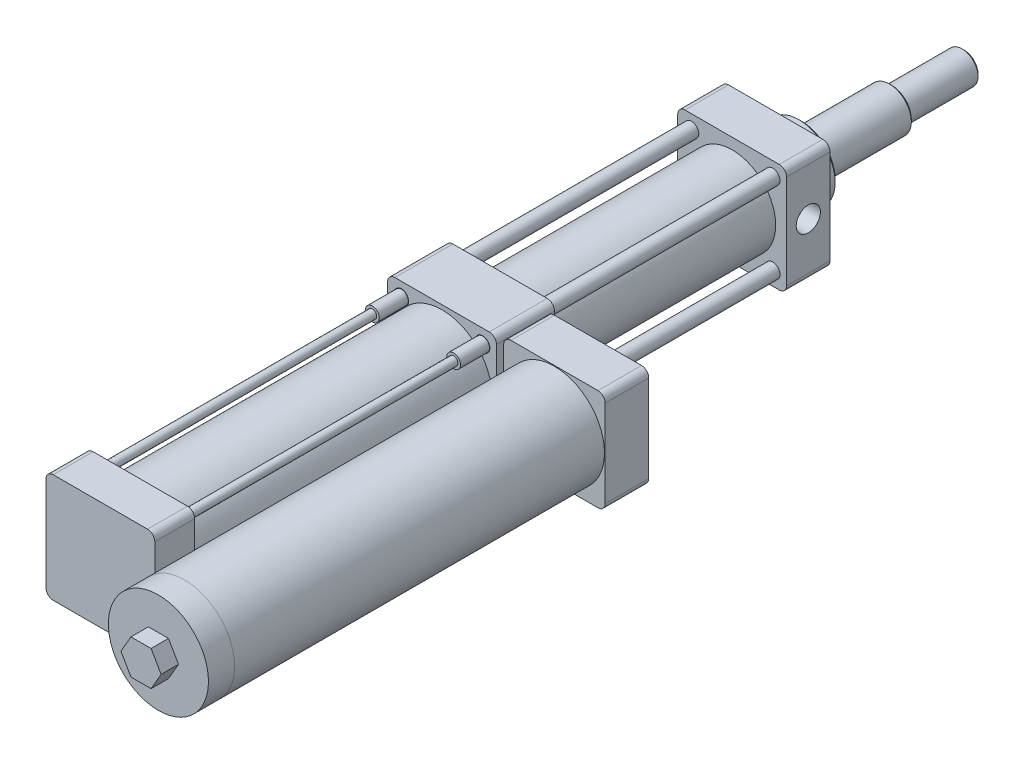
SolidWorks part; units mm, degrees
ref_plane "前视基准面" through (0, 0, 0) normal (0, 0, 1) x (1, 0, 0)
ref_plane "上视基准面" through (0, 0, 0) normal (0, 1, 0) x (1, 0, 0)
ref_plane "右视基准面" through (0, 0, 0) normal (1, 0, 0) x (0, 0, -1)
sketch "草图1" plane through (0, 0, 0) normal (0, 0, 1) x (1, 0, 0)
  line L0 (0, 0) -> (28, 0) construction
  line L1 (32.5, 37.5) -> (-32.5, 37.5)
  line L2 (37.5, 32.5) -> (37.5, -32.5)
  line L3 (32.5, -37.5) -> (-32.5, -37.5)
  line L4 (-37.5, 32.5) -> (-37.5, -32.5)
  line L5 (37.5, 37.5) -> (-37.5, -37.5) construction
  line L6 (37.5, -37.5) -> (-37.5, 37.5) construction
  line L7 (28, 0) -> (28, -28) construction
  arc A0 (-37.5, -32.5) -> (-32.5, -37.5) centre (-32.5, -32.5) ccw
  arc A1 (37.5, -32.5) -> (32.5, -37.5) centre (32.5, -32.5) cw
  arc A2 (32.5, 37.5) -> (37.5, 32.5) centre (32.5, 32.5) cw
  arc A3 (-37.5, 32.5) -> (-32.5, 37.5) centre (-32.5, 32.5) cw
  circle A4 centre (28, -28) radius 5
  circle A5 centre (-28, -28) radius 5
  circle A6 centre (-28, 28) radius 5
  circle A7 centre (28, 28) radius 5
  point P0 (0, 0)
  point P31 (0, 0)
  dimension "D3" = 5
  dimension "D4" = 4
  dimension "D1" = 75
  dimension "D2" = 75
extrude "凸台-拉伸1" add sketch "草图1" along normal blind 30
sketch "草图2" plane through (0, 0, 0) normal (0, 0, -1) x (-1, 0, 0)
  circle A0 centre (0, 0) radius 25
extrude "凸台-拉伸2" add sketch "草图2" along normal blind 18
sketch "草图3" plane through (0, 0, -18) normal (0, 0, -1) x (-1, 0, 0)
  circle A0 centre (0, 0) radius 15
extrude "凸台-拉伸3" add sketch "草图3" along normal blind 62
sketch "草图4" plane through (0, 0, -80) normal (0, 0, -1) x (-1, 0, 0)
  circle A0 centre (0, 0) radius 11
extrude "凸台-拉伸4" add sketch "草图4" along normal blind 50
chamfer "倒角1" distance 2 angle 45 1 edges at (-25, 0, -18)
chamfer "倒角2" distance 1.5 angle 45 2 edges at (-11, 0, -130) (-15, 0, -80)
sketch "草图5" plane through (0, 0, 30) normal (0, 0, 1) x (1, 0, 0)
  circle A0 centre (0, 0) radius 30
extrude "凸台-拉伸5" add sketch "草图5" along normal blind 160
sketch "草图6" plane through (0, 0, 190) normal (0, 0, 1) x (1, 0, 0)
  line L4 (-32.5, -37.5) -> (32.5, -37.5)
  line L5 (37.5, -32.5) -> (37.5, 32.5)
  line L6 (32.5, 37.5) -> (-32.5, 37.5)
  line L7 (-37.5, 32.5) -> (-37.5, -32.5)
  line L8 (-32.5, -37.5) -> (32.5, -37.5)
  line L9 (37.5, -32.5) -> (37.5, 32.5)
  line L10 (32.5, 37.5) -> (-32.5, 37.5)
  line L11 (-37.5, 32.5) -> (-37.5, -32.5)
  circle A0 centre (-28, -28) radius 5 construction
  circle A1 centre (-28, 28) radius 5 construction
  circle A2 centre (28, -28) radius 5 construction
  circle A3 centre (28, 28) radius 5 construction
  arc A4 (-37.5, -32.5) -> (-32.5, -37.5) centre (-32.5, -32.5) ccw
  arc A5 (32.5, -37.5) -> (37.5, -32.5) centre (32.5, -32.5) ccw
  arc A6 (37.5, 32.5) -> (32.5, 37.5) centre (32.5, 32.5) ccw
  arc A7 (-32.5, 37.5) -> (-37.5, 32.5) centre (-32.5, 32.5) ccw
  arc A8 (-37.5, -32.5) -> (-32.5, -37.5) centre (-32.5, -32.5) ccw
  arc A9 (32.5, -37.5) -> (37.5, -32.5) centre (32.5, -32.5) ccw
  arc A10 (37.5, 32.5) -> (32.5, 37.5) centre (32.5, 32.5) ccw
  arc A11 (-32.5, 37.5) -> (-37.5, 32.5) centre (-32.5, 32.5) ccw
  circle A12 centre (-28, -28) radius 5
  circle A13 centre (-28, 28) radius 5
  circle A14 centre (28, -28) radius 5
  circle A15 centre (28, 28) radius 5
  dimension "D1" = 0
extrude "凸台-拉伸6" add sketch "草图6" along normal blind 40
sketch "草图7" plane through (0, 0, 230) normal (0, 0, 1) x (1, 0, 0)
  circle A0 centre (0, 0) radius 34.5
extrude "凸台-拉伸7" add sketch "草图7" along normal blind 208
sketch "草图8" plane through (0, 0, 230) normal (0, 0, 1) x (1, 0, 0)
  circle A0 centre (28, 28) radius 4.75
  circle A1 centre (28, -28) radius 4.75
  circle A2 centre (-28, 28) radius 4.75
  circle A3 centre (-28, -28) radius 4.75
extrude "凸台-拉伸8" add sketch "草图8" along normal blind 20 separate body
sketch "草图9" plane through (0, 0, 438) normal (0, 0, 1) x (1, 0, 0)
  line L4 (-32.5, -37.5) -> (32.5, -37.5)
  line L5 (37.5, -32.5) -> (37.5, 32.5)
  line L6 (32.5, 37.5) -> (-32.5, 37.5)
  line L7 (-37.5, 32.5) -> (-37.5, -32.5)
  line L8 (-32.5, -37.5) -> (32.5, -37.5)
  line L9 (37.5, -32.5) -> (37.5, 32.5)
  line L10 (32.5, 37.5) -> (-32.5, 37.5)
  line L11 (-37.5, 32.5) -> (-37.5, -32.5)
  arc A4 (-37.5, -32.5) -> (-32.5, -37.5) centre (-32.5, -32.5) ccw
  arc A5 (32.5, -37.5) -> (37.5, -32.5) centre (32.5, -32.5) ccw
  arc A6 (37.5, 32.5) -> (32.5, 37.5) centre (32.5, 32.5) ccw
  arc A7 (-32.5, 37.5) -> (-37.5, 32.5) centre (-32.5, 32.5) ccw
  arc A8 (-37.5, -32.5) -> (-32.5, -37.5) centre (-32.5, -32.5) ccw
  arc A9 (32.5, -37.5) -> (37.5, -32.5) centre (32.5, -32.5) ccw
  arc A10 (37.5, 32.5) -> (32.5, 37.5) centre (32.5, 32.5) ccw
  arc A11 (-32.5, 37.5) -> (-37.5, 32.5) centre (-32.5, 32.5) ccw
  dimension "D1" = 0
extrude "凸台-拉伸9" add sketch "草图9" along normal blind 27.5
ref_plane "基准面1" through (0, 0, 195) normal (0, 0, -1) x (-1, 0, 0)
sketch "草图10" plane through (0, 0, 195) normal (0, 0, -1) x (-1, 0, 0)
  line L2 (-37.5, 0) -> (-72.5, 0) construction
  line L4 (-102.5, 35) -> (-42.5, 35)
  line L5 (-107.5, 30) -> (-107.5, -30)
  line L6 (-102.5, -35) -> (-42.5, -35)
  line L7 (-37.5, 30) -> (-37.5, -30)
  line L8 (-107.5, 35) -> (-37.5, -35) construction
  line L9 (-107.5, -35) -> (-37.5, 35) construction
  arc A0 (-107.5, 30) -> (-102.5, 35) centre (-102.5, 30) cw
  arc A1 (-42.5, 35) -> (-37.5, 30) centre (-42.5, 30) cw
  arc A2 (-42.5, -35) -> (-37.5, -30) centre (-42.5, -30) ccw
  arc A3 (-107.5, -30) -> (-102.5, -35) centre (-102.5, -30) ccw
  dimension "D3" = 5
  dimension "D1" = 70
  dimension "D2" = 70
extrude "凸台-拉伸10" add sketch "草图10" against normal blind 30
sketch "草图11" plane through (0, 0, 225) normal (0, 0, 1) x (1, 0, 0)
  line L0 (72.5, 35) -> (72.5, -35) construction
  line L1 (42.5, 35) -> (102.5, 35) construction
  circle A0 centre (72.5, 0) radius 34.5
extrude "凸台-拉伸11" add sketch "草图11" along normal blind 255
sketch "草图12" plane through (0, 0, 480) normal (0, 0, 1) x (1, 0, 0)
  circle A0 centre (72.5, 0) radius 34.5
extrude "凸台-拉伸12" add sketch "草图12" along normal blind 18 separate body
sketch "草图13" plane through (0, 0, 498) normal (0, 0, 1) x (1, 0, 0)
  line L1 (86.3564, 0) -> (79.4282, 12)
  line L2 (79.4282, 12) -> (65.5718, 12)
  line L3 (65.5718, 12) -> (58.6436, 0)
  line L4 (58.6436, 0) -> (65.5718, -12)
  line L5 (65.5718, -12) -> (79.4282, -12)
  line L6 (79.4282, -12) -> (86.3564, 0)
  circle A0 centre (72.5, 0) radius 12 construction
extrude "凸台-拉伸13" add sketch "草图13" along normal blind 12
sketch "草图14" plane through (0, 0, 250) normal (0, 0, 1) x (1, 0, 0)
  circle A0 centre (28, 28) radius 3
  circle A1 centre (-28, 28) radius 3
  circle A2 centre (-28, -28) radius 3
  circle A3 centre (28, -28) radius 3
extrude "凸台-拉伸14" add sketch "草图14" along normal up to surface (188 mm away)
sketch "草图15" plane through (0, 0, 0) normal (0, 0, -1) x (-1, 0, 0)
  circle A0 centre (28, 28) radius 5 construction
  circle A1 centre (28, -28) radius 5 construction
  circle A2 centre (-28, 28) radius 5 construction
  circle A3 centre (-28, -28) radius 5 construction
  circle A4 centre (28, 28) radius 5
  circle A5 centre (28, -28) radius 5
  circle A6 centre (-28, 28) radius 5
  circle A7 centre (-28, -28) radius 5
extrude "凸台-拉伸15" add sketch "草图15" against normal up to surface (190 mm away) separate body
hole_wizard "3/8 Rc 螺纹孔1" positions "草图16" profile "草图17" size "3/8" standard "ISO"
sketch "草图16" plane through (0, -37.5, 0) normal (0, -1, 0) x (-1, 0, 0)
  line L0 (-34.5, -230) -> (34.5, -230) construction
  line L1 (32.5, -465.5) -> (-32.5, -465.5) construction
  point P0 (0, -451.75)
  point P2 (0, -210)
  dimension "D1" = 20
  dimension "D2" = 13.75
sketch "草图17" plane through (0, -37.5, 451.75) normal (1, 0, 0) x (0, 0, -1)
  line L0 (0, 0) -> (0, 22.3862)
  line L1 (7.15, 18.09) -> (0, 22.3862)
  line L2 (-7.15, 18.09) -> (0, 22.3862) construction
  line L3 (7.15, 18.09) -> (7.15, 11.4)
  line L4 (7.15, 11.4) -> (7.9751, 11.4)
  line L5 (7.9751, 11.4) -> (8.331, 0)
  line L6 (-7.9751, 11.4) -> (-8.331, 0) construction
  line L7 (8.331, 0) -> (0, 0)
  line L8 (0, -6.35) -> (0, 107.95) construction
  line L11 (-7.15, 11.4) -> (-7.9751, 11.4) construction
  dimension "螺纹孔钻头直径" = 14.3
  dimension "螺纹孔钻头深度" = 18.09
  dimension "螺纹直径" = 16.662
  dimension "螺纹角度" = 3.576
  dimension "螺纹深度" = 11.4
  dimension "导头角度" = 118
hole_wizard "3/8 Rc 螺纹孔2" positions "草图18" profile "草图19" size "3/8" standard "ISO"
sketch "草图18" plane through (37.5, 0, 0) normal (1, 0, 0) x (0, 0, -1)
  line L0 (-30, -32.5) -> (-30, 32.5) construction
  point P0 (-15, 0)
  dimension "D1" = 15
sketch "草图19" plane through (37.5, 0, 15) normal (0, 1, 0) x (0, 0, -1)
  line L0 (0, 0) -> (0, 22.3862)
  line L1 (7.15, 18.09) -> (0, 22.3862)
  line L2 (-7.15, 18.09) -> (0, 22.3862) construction
  line L3 (7.15, 18.09) -> (7.15, 11.4)
  line L4 (7.15, 11.4) -> (7.9751, 11.4)
  line L5 (7.9751, 11.4) -> (8.331, 0)
  line L6 (-7.9751, 11.4) -> (-8.331, 0) construction
  line L7 (8.331, 0) -> (0, 0)
  line L8 (0, -6.35) -> (0, 107.95) construction
  line L11 (-7.15, 11.4) -> (-7.9751, 11.4) construction
  dimension "螺纹孔钻头直径" = 14.3
  dimension "螺纹孔钻头深度" = 18.09
  dimension "螺纹直径" = 16.662
  dimension "螺纹角度" = 3.576
  dimension "螺纹深度" = 11.4
  dimension "导头角度" = 118
